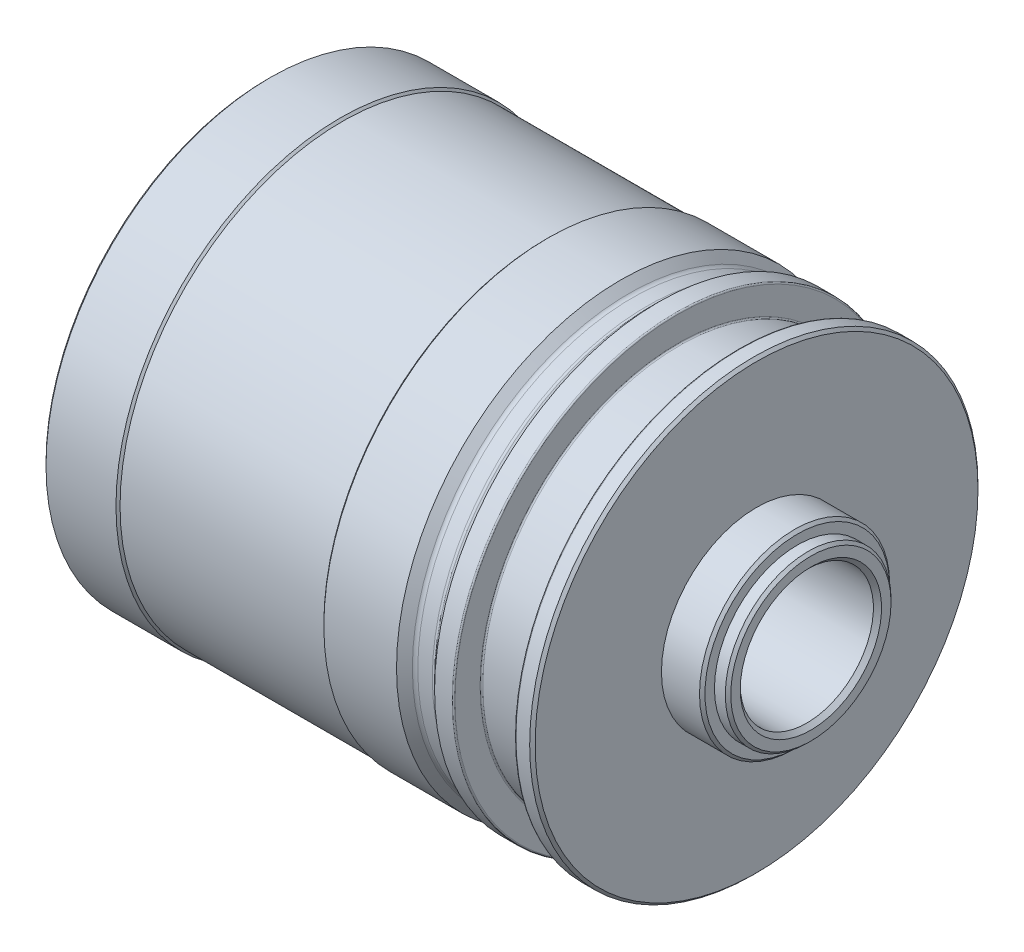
SolidWorks part; units mm, degrees
ref_plane "Piano frontale" through (0, 0, 0) normal (0, 0, 1) x (1, 0, 0)
ref_plane "Piano superiore" through (0, 0, 0) normal (0, 1, 0) x (1, 0, 0)
ref_plane "Piano destro" through (0, 0, 0) normal (1, 0, 0) x (0, 0, -1)
ref_plane "Piano1" through (0, 0, 0) normal (0, 0, -1) x (-1, 0, 0)
sketch "Schizzo1" plane through (0, 0, 0) normal (0, 0, -1) x (-1, 0, 0)
  line L0 (21.3, 15) -> (40, 15)
  line L1 (5.3, 16.5) -> (4, 16.5)
  line L3 (4, 16.5) -> (4, 7)
  line L4 (4, 7) -> (1, 7)
  line L5 (1, 7) -> (1, 6.1)
  line L6 (1, 6.1) -> (0, 6.1)
  line L7 (0, 6.1) -> (0, 5.2)
  line L8 (0, 5.2) -> (0.3, 4.9)
  line L9 (0.3, 4.9) -> (11.3, 4.9)
  line L10 (11.3, 4.9) -> (11.3, 4)
  line L11 (11.3, 4) -> (21.3, 4)
  line L12 (21.3, 4) -> (21.3, 15)
  line L14 (40, 15) -> (40, 16.5)
  line L17 (40, 16.5) -> (9.8, 16.5)
  line L19 (9.8, 16.5) -> (9.8, 14.55)
  line L20 (9.7, 14.45) -> (5.7, 14.45)
  line L21 (5.3, 14.85) -> (5.3, 16.5)
  line L22 (-8, 0) -> (2, 0) construction
  line L23 (9.8, 16.8958) -> (9.8, 16.5) construction
  line L24 (9.8, 16.5) -> (9, 16.5) construction
  line L25 (5.3, 16.8958) -> (5.3, 16.5) construction
  line L26 (5.3, 16.5) -> (5.1, 16.5) construction
  line L29 (0.3, 4.9) -> (0, 4.9) construction
  line L30 (0, 4.9) -> (0, 5.2) construction
  line L31 (0, 6.1) -> (0, 7) construction
  line L32 (0, 7) -> (1, 7) construction
  line L33 (9.9, 14.45) -> (10.3, 14.45) construction
  line L34 (10.3, 14.45) -> (10.3, 14.85) construction
  line L35 (5.7, 14.45) -> (5.3, 14.45) construction
  line L36 (5.3, 14.45) -> (5.3, 14.85) construction
  arc A1 (5.7, 14.45) -> (5.3, 14.85) centre (5.7, 14.85) cw
  arc A2 (9.8, 14.55) -> (9.7, 14.45) centre (9.7, 14.55) cw
  dimension "D15" = 0.4
  dimension "D16" = 36
  dimension "D12" = 0.1
  dimension "D1" = 9.8
  dimension "D2" = 8
  dimension "D3" = 6.1
  dimension "D4" = 14
  dimension "D5" = 28.9
  dimension "D6" = 30
  dimension "D7" = 11.3
  dimension "D8" = 33
  dimension "D11" = 4.5
  dimension "D18" = 3
  dimension "D19" = 10
  dimension "D20" = 135
  dimension "D21" = 1
  dimension "D22" = 0.3
  dimension "D26" = 1.3
revolve "Rivoluzione1" add sketch "Schizzo1" angle 360 about L22
sketch "Schizzo2" plane through (0, 0, 0) normal (0, 1, 0) x (1, 0, 0)
  line L0 (-4, -16.5) -> (-4, 16.5) construction
  line L2 (-11.2, 16.5) -> (-11.9, 15.8)
  line L3 (-11.9, 15.8) -> (-13.3, 15.8)
  line L4 (-13.3, 15.8) -> (-14, 16.5)
  line L5 (-12.6, 15.8) -> (-12.6, 19.6397) construction
  line L6 (8, 0) -> (18, 0) construction
  line L7 (-14, 16.5) -> (-11.2, 16.5)
  line L8 (0, 0) -> (-14.7379, 0) construction
  dimension "D1" = 1.4
  dimension "D2" = 15.8
  dimension "D3" = 16.5
  dimension "D4" = 8.6
revolve "Taglia-Rivoluzione1" cut sketch "Schizzo2" angle 360 about axis through (8, 0, 0) along (-1, 0, 0)
chamfer "Smusso2" distance 0.2 angle 45 5 edges at (-1, 0, 7) (-40, 0, 16.5) (-21.3, 0, 4) (-40, 0, 15) (0, 0, 6.1)
fillet "Raccordo1" radius 0.4 2 edges at (-13.3, 0, 15.8) (-11.9, 0, 15.8)
fillet "Raccordo2" radius 0.1 2 edges at (-9.8, 0, 16.5) (-5.3, 0, 16.5)
chamfer "Smusso3" distance 0.2 angle 45 1 edges at (-4, 0, 16.5)
sketch "Schizzo3" plane through (0, 0, 0) normal (0, 0, 1) x (1, 0, 0)
  line L0 (-34.65, 16.5) -> (-34.5, 16.35)
  line L1 (-14, 16.5) -> (-39.8, 16.5) construction
  line L2 (-34.5, 16.35) -> (-19.5, 16.35)
  line L3 (-19.5, 16.35) -> (-19.35, 16.5)
  line L4 (-19.35, 16.5) -> (-34.65, 16.5)
  line L5 (-40, 16.3) -> (-40, -16.3) construction
  dimension "D1" = 15
  dimension "D2" = 5.5
  dimension "D3" = 45
  dimension "D4" = 45
  dimension "D5" = 0.15
revolve "Taglia-Rivoluzione2" cut sketch "Schizzo3" angle 360 about axis through (8, 0, 0) along (-1, 0, 0)
